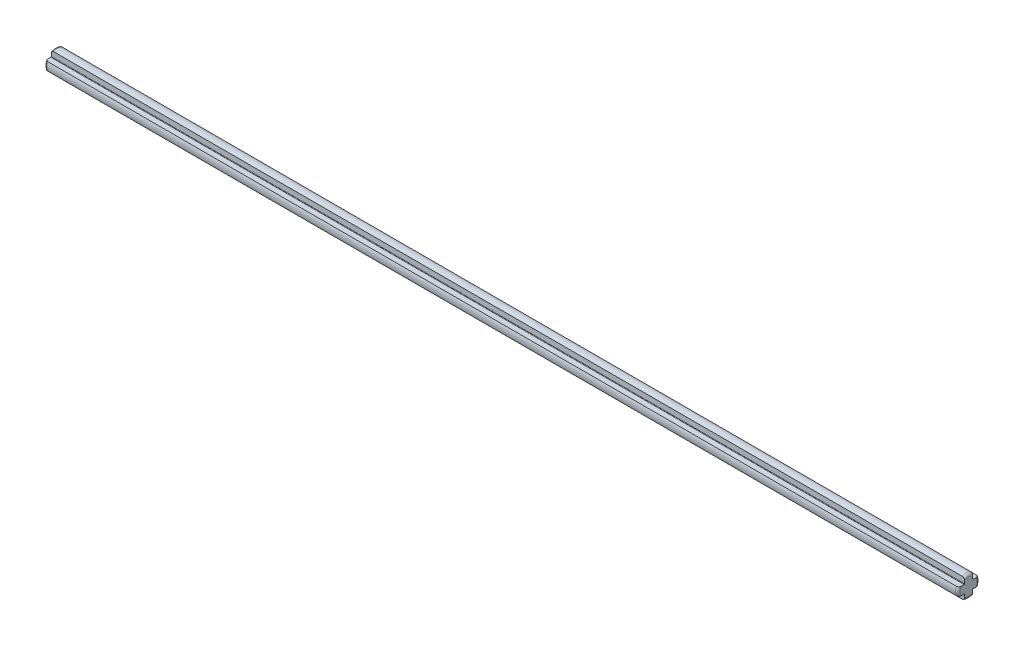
SolidWorks part; units mm, degrees
ref_plane "Alzado" through (0, 0, 0) normal (0, 0, 1) x (1, 0, 0)
ref_plane "Planta" through (0, 0, 0) normal (0, 1, 0) x (1, 0, 0)
ref_plane "Vista lateral" through (0, 0, 0) normal (1, 0, 0) x (0, 0, -1)
sketch "Croquis1" plane through (0, 0, 0) normal (1, 0, 0) x (0, 0, -1)
  line L0 (-3.7919, 0) -> (3.9132, 0) construction
  line L1 (-0.9, 2.1708) -> (-0.9, 1)
  line L2 (-2.1708, 0.9) -> (-1, 0.9)
  line L3 (2.1708, 0.9) -> (1, 0.9)
  line L4 (0.9, 2.1708) -> (0.9, 1)
  line L5 (0, 3.4809) -> (0, -0.8787) construction
  line L6 (0.9, -2.1708) -> (0.9, -1)
  line L7 (2.1708, -0.9) -> (1, -0.9)
  line L8 (-2.1708, -0.9) -> (-1, -0.9)
  line L9 (-0.9, -2.1708) -> (-0.9, -1)
  arc A0 (-2.1708, 0.9) -> (-2.1708, -0.9) centre (0, 0) ccw
  arc A1 (0.9, 2.1708) -> (-0.9, 2.1708) centre (0, 0) ccw
  arc A2 (-1, 0.9) -> (-0.9, 1) centre (-1, 1) ccw
  arc A3 (1, 0.9) -> (0.9, 1) centre (1, 1) cw
  arc A4 (2.1708, 0.9) -> (2.1708, -0.9) centre (0, 0) cw
  arc A5 (1, -0.9) -> (0.9, -1) centre (1, -1) ccw
  arc A6 (-1, -0.9) -> (-0.9, -1) centre (-1, -1) cw
  arc A7 (0.9, -2.1708) -> (-0.9, -2.1708) centre (0, 0) cw
  dimension "D1" = 2.35
  dimension "D4" = 0.1
  dimension "D2" = 1.8
  dimension "D3" = 1.8
extrude "Extruir1" add sketch "Croquis1" along normal mid plane 200
fillet "Redondeo1" radius 0.5 8 edges at (100, 2.35, 0) (100, 0, -2.35) (100, -2.35, 0) (100, 0, 2.35) (-100, -2.35, 0) (-100, 0, -2.35) (-100, 2.35, 0) (-100, 0, 2.35)
